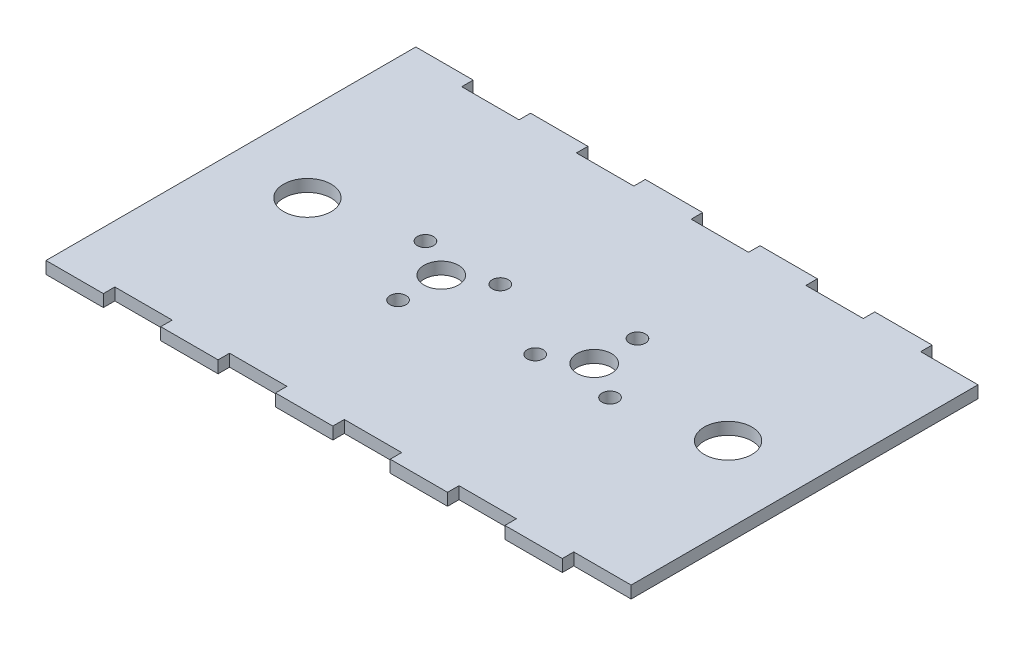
SolidWorks part; units mm, degrees
ref_plane "Front Plane" through (0, 0, 0) normal (0, 0, 1) x (1, 0, 0)
ref_plane "Top Plane" through (0, 0, 0) normal (0, 1, 0) x (1, 0, 0)
ref_plane "Right Plane" through (0, 0, 0) normal (1, 0, 0) x (0, 0, -1)
sketch "alignment holes" plane through (0, 0, 0) normal (0, 1, 0) x (1, 0, 0)
  line L0 (20, 90.7) -> (20, 0) construction
  line L1 (0, 0) -> (150, 0)
  line L2 (0, 0) -> (0, 90.7)
  line L3 (0, 90.7) -> (150, 90.7)
  line L4 (150, 0) -> (150, 90.7)
  line L5 (130, 90.7) -> (130, 0) construction
  line L6 (95, 90.7) -> (95, 0) construction
  line L7 (55, 90.7) -> (55, 0) construction
  circle A0 centre (95, 45.35) radius 4.5
  circle A1 centre (95, 56.65) radius 2.1
  circle A2 centre (85.2139, 39.7) radius 2.1
  circle A3 centre (104.7861, 39.7) radius 2.1
  circle A4 centre (55, 45.35) radius 4.5
  circle A5 centre (55, 34.05) radius 2.1
  circle A6 centre (45.2139, 51) radius 2.1
  circle A7 centre (64.7861, 51) radius 2.1
  circle A8 centre (20, 45.35) radius 6.225
  circle A9 centre (130, 45.35) radius 6.225
  point P22 (95, 45.35)
  point P33 (55, 45.35)
  dimension "D6" = 11.3
  dimension "D7" = 9
  dimension "D8" = 4.2
  dimension "D11" = 11.3
  dimension "motorspace" = 75
  dimension "D2" = 35
  dimension "edgespace" = 20
  dimension "D4" = 20
  dimension "D5" = 90.7
  dimension "D10" = 35
  dimension "D9" = 3
  dimension "D12" = 3
extrude "body" add sketch "alignment holes" along normal blind 3.175
sketch "tabs" plane through (0, 3.175, 0) normal (0, 1, 0) x (1, 0, 0)
  line L0 (0, 45.35) -> (150, 45.35) construction
  line L1 (0, 90.7) -> (15, 90.7)
  line L2 (0, 90.7) -> (0, 93.7)
  line L3 (0, 93.7) -> (15, 93.7)
  line L4 (15, 90.7) -> (15, 93.7)
  line L5 (0, 90.7) -> (0, 0) construction
  line L6 (150, 0) -> (150, 90.7) construction
  line L7 (15, 0) -> (15, -3)
  line L8 (0, -3) -> (15, -3)
  line L9 (0, 0) -> (0, -3)
  line L10 (0, 0) -> (15, 0)
  line L11 (30, 90.7) -> (45, 90.7)
  line L12 (30, 90.7) -> (30, 93.7)
  line L13 (30, 93.7) -> (45, 93.7)
  line L14 (45, 90.7) -> (45, 93.7)
  line L15 (45, 0) -> (45, -3)
  line L16 (30, -3) -> (45, -3)
  line L17 (30, 0) -> (30, -3)
  line L18 (30, 0) -> (45, 0)
  line L19 (60, 90.7) -> (75, 90.7)
  line L20 (60, 90.7) -> (60, 93.7)
  line L21 (60, 93.7) -> (75, 93.7)
  line L22 (75, 90.7) -> (75, 93.7)
  line L23 (75, 0) -> (75, -3)
  line L24 (60, -3) -> (75, -3)
  line L25 (60, 0) -> (60, -3)
  line L26 (60, 0) -> (75, 0)
  line L27 (90, 90.7) -> (105, 90.7)
  line L28 (90, 90.7) -> (90, 93.7)
  line L29 (90, 93.7) -> (105, 93.7)
  line L30 (105, 90.7) -> (105, 93.7)
  line L31 (105, 0) -> (105, -3)
  line L32 (90, -3) -> (105, -3)
  line L33 (90, 0) -> (90, -3)
  line L34 (90, 0) -> (105, 0)
  line L35 (120, 90.7) -> (135, 90.7)
  line L36 (120, 90.7) -> (120, 93.7)
  line L37 (120, 93.7) -> (135, 93.7)
  line L38 (135, 90.7) -> (135, 93.7)
  line L39 (135, 0) -> (135, -3)
  line L40 (120, -3) -> (135, -3)
  line L41 (120, 0) -> (120, -3)
  line L42 (120, 0) -> (135, 0)
  dimension "D1" = 5
  dimension "tabwidth" = 15
  dimension "tabheight" = 3
extrude "xtabs" add sketch "tabs" against normal up to surface (3.175 mm away)
